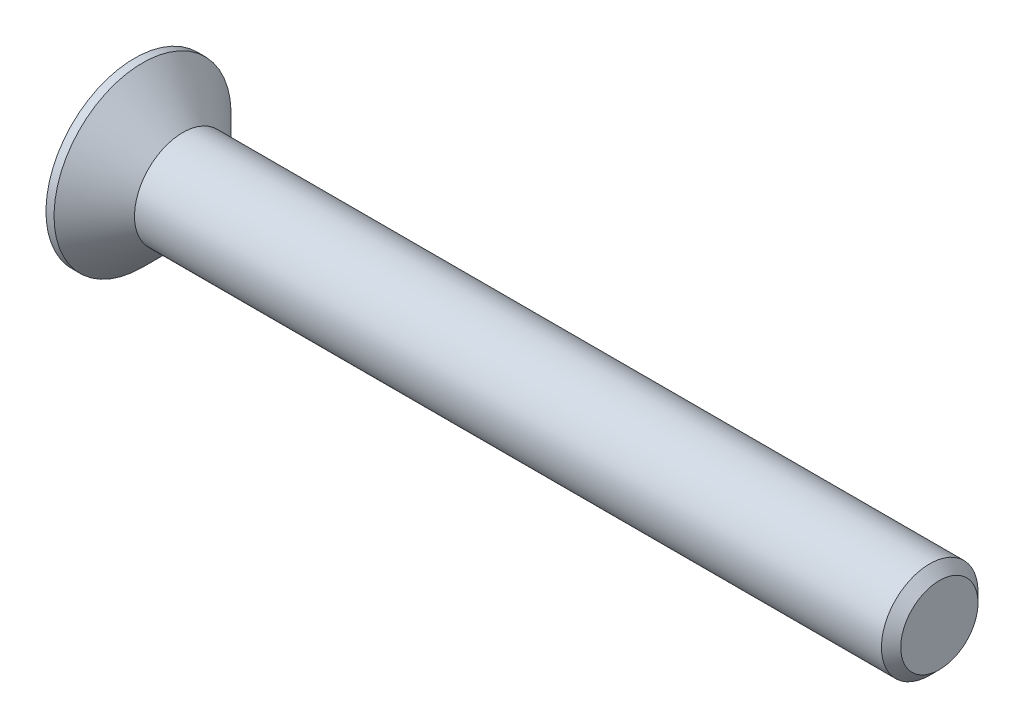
SolidWorks part; units mm, degrees
ref_plane "Front Plane" through (0, 0, 0) normal (0, 0, 1) x (1, 0, 0)
ref_plane "Top Plane" through (0, 0, 0) normal (0, 1, 0) x (1, 0, 0)
ref_plane "Right Plane" through (0, 0, 0) normal (1, 0, 0) x (0, 0, -1)
sketch "Sketch1" plane through (0, 0, 0) normal (0, 0, 1) x (1, 0, 0)
  line L1 (-3, 5.5) -> (-3, 0)
  line L2 (-3, 0) -> (47, 0)
  line L3 (47, 0) -> (47, 3)
  line L4 (47, 3) -> (0, 3)
  line L5 (-3, 5.5) -> (-2.5, 5.5)
  line L6 (-2.5, 5.5) -> (0, 3)
  dimension "D1" = 3
  dimension "D2" = 45
  dimension "D3" = 3
  dimension "D4" = 50
  dimension "D5" = 5.5
revolve "Revolve1" add sketch "Sketch1" angle 360 about L2
chamfer "Chamfer1" distance 0.6 angle 45 1 edges at (47, -3, 0)
sketch "Sketch2" plane through (-3, 0, 0) normal (-1, 0, 0) x (0, 0, 1)
  line L0 (-0.825, 3.3) -> (0.825, 3.3)
  line L1 (0.825, 3.3) -> (0.825, 0.825)
  line L2 (0.825, 0.825) -> (3.3, 0.825)
  line L3 (3.3, 0.825) -> (3.3, -0.825)
  line L4 (3.3, -0.825) -> (0.825, -0.825)
  line L5 (0.825, -0.825) -> (0.825, -3.3)
  line L6 (0.825, -3.3) -> (-0.825, -3.3)
  line L7 (-0.825, -3.3) -> (-0.825, -0.825)
  line L8 (-0.825, -0.825) -> (-3.3, -0.825)
  line L9 (-3.3, -0.825) -> (-3.3, 0.825)
  line L10 (-3.3, 0.825) -> (-0.825, 0.825)
  line L11 (-0.825, 0.825) -> (-0.825, 3.3)
  point P2 (0, 3.3)
  point P14 (0, -3.3)
  point P15 (3.3, 0)
  point P16 (-3.3, 0)
  dimension "D1" = 6.6
  dimension "D2" = 1.65
extrude "Cut-Extrude1" cut sketch "Sketch2" against normal blind 2.5
